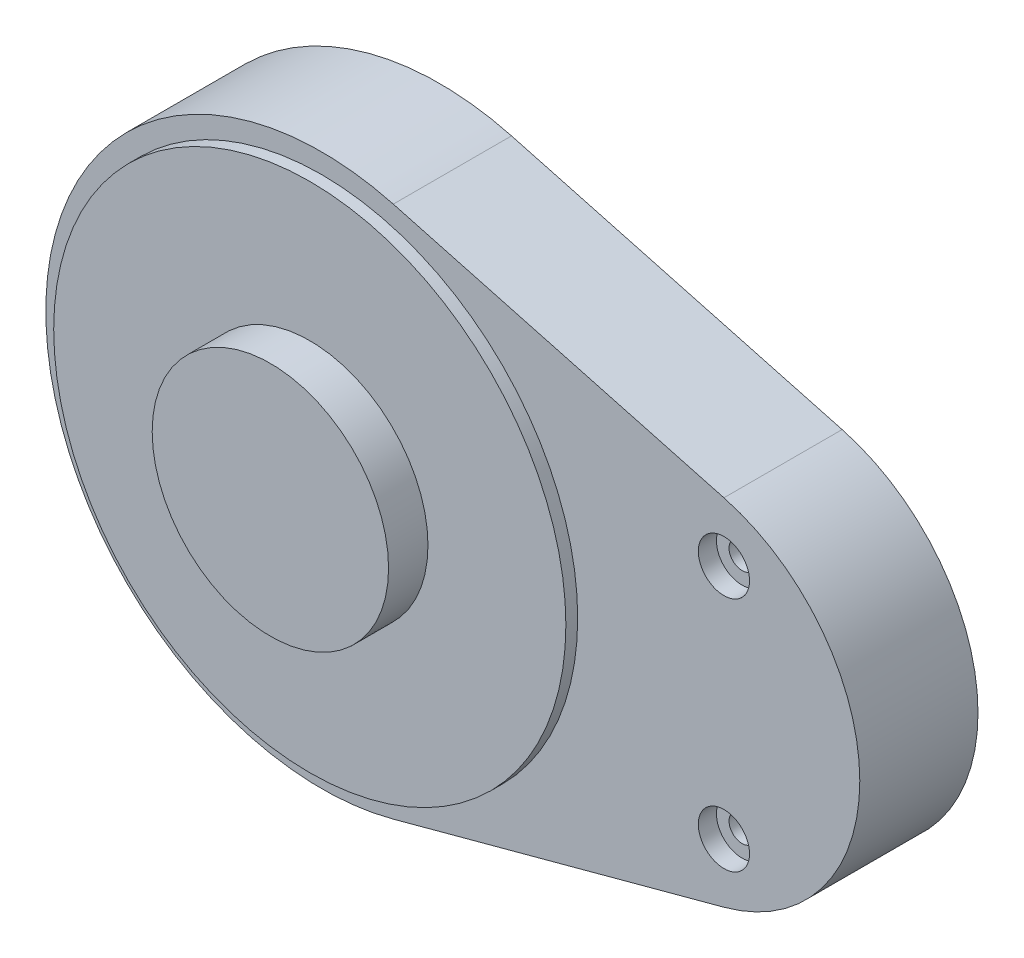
SolidWorks part; units mm, degrees
ref_plane "Front Plane" through (0, 0, 0) normal (0, 0, 1) x (1, 0, 0)
ref_plane "Top Plane" through (0, 0, 0) normal (0, 1, 0) x (1, 0, 0)
ref_plane "Right Plane" through (0, 0, 0) normal (1, 0, 0) x (0, 0, -1)
sketch "Sketch1" plane through (0, 0, 0) normal (0, 0, 1) x (1, 0, 0)
  line L0 (12.1154, 172.0095) -> (-71.8019, 194.6026) construction
  line L1 (-71.8019, 59.4164) -> (12.1154, 82.0095) construction
  line L2 (12.1154, 172.0095) -> (-71.8019, 194.6026)
  line L3 (-71.8019, 59.4164) -> (12.1154, 82.0095)
  arc A0 (12.1154, 82.0095) -> (12.1154, 172.0095) centre (0, 127.0095) ccw construction
  arc A1 (-71.8019, 194.6026) -> (-71.8019, 59.4164) centre (-90, 127.0095) ccw construction
  arc A2 (12.1154, 82.0095) -> (12.1154, 172.0095) centre (0, 127.0095) ccw
  arc A3 (-71.8019, 194.6026) -> (-71.8019, 59.4164) centre (-90, 127.0095) ccw
extrude "Boss-Extrude1" add sketch "Sketch1" along normal blind 30
sketch "Sketch2" plane through (0, 0, 0) normal (0, 0, -1) x (-1, 0, 0)
  line L1 (105, 142.0095) -> (75, 142.0095)
  line L2 (105, 142.0095) -> (105, 112.0095)
  line L3 (105, 112.0095) -> (75, 112.0095)
  line L4 (75, 142.0095) -> (75, 112.0095)
extrude "Boss-Extrude2" add sketch "Sketch2" along normal blind 10
sketch "Sketch3" plane through (0, 0, 30) normal (0, 0, 1) x (1, 0, 0)
  circle A0 centre (-90, 127.0095) radius 65
  dimension "D1" = 130
extrude "Boss-Extrude3" add sketch "Sketch3" along normal blind 3
sketch "Sketch4" plane through (0, 0, 33) normal (0, 0, 1) x (1, 0, 0)
  circle A0 centre (-90, 127.0095) radius 30
  dimension "D1" = 60
extrude "Boss-Extrude4" add sketch "Sketch4" along normal blind 10
hole_wizard "CBORE for M6 Pan Head Screw1" positions "3DSketch1" profile "Sketch5" counterbore size "M6" standard "ISO"
sketch3d "3DSketch1"
  line L0 (46.6024, 127.0095, 30) -> (-16.395, 127.0095, 30) construction
  arc A0 (12.1154, 82.0095, 30) -> (12.1154, 172.0095, 30) centre (0, 127.0095, 30) ccw construction
  point P0 (12.1154, 157.0095, 30)
  point P2 (12.1154, 97.0095, 30)
  point P14 (0, 127.0095, 76.6024)
  dimension "D1" = 60
  dimension "D2" = 60
sketch "Sketch5" plane through (12.1154, 157.0095, 30) normal (1, 0, 0) x (0, -1, 0)
  line L0 (0, 0) -> (0, 52.4828)
  line L1 (0, 52.4828) -> (3.3, 50.5)
  line L2 (3.3, 50.5) -> (3.3, 4.6)
  line L3 (3.3, 4.6) -> (6.5, 4.6)
  line L4 (6.5, 4.6) -> (6.5, 0)
  line L5 (6.5, 0) -> (0, 0)
  line L10 (0, 52.4828) -> (-3.3, 50.5) construction
  line L11 (0, -6.35) -> (0, 107.95) construction
  dimension "Hole Dia." = 6.6
  dimension "Hole Depth" = 50.5
  dimension "C'Bore Dia." = 13
  dimension "C'Bore Depth" = 4.6
  dimension "Drill Angle" = 118
